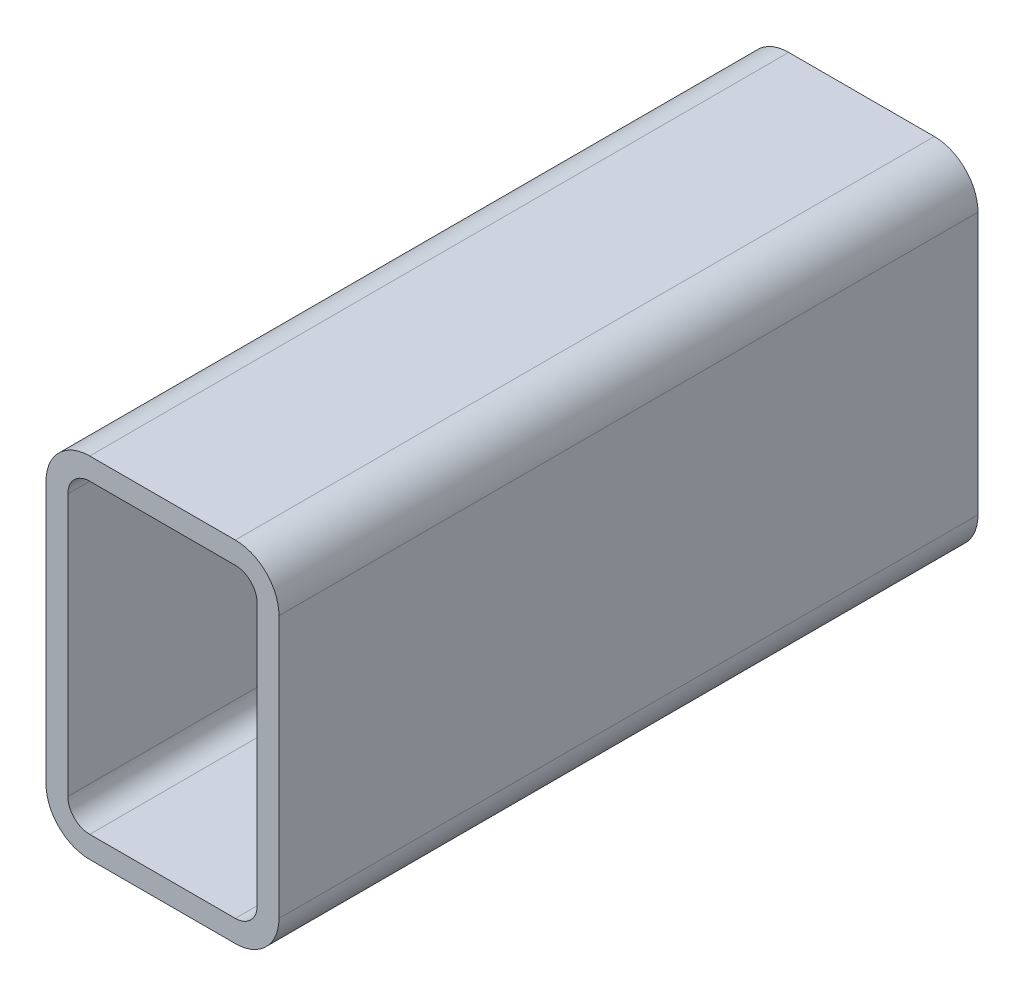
SolidWorks part; units mm, degrees
ref_plane "Front Plane" through (0, 0, 0) normal (0, 0, 1) x (1, 0, 0)
ref_plane "Top Plane" through (0, 0, 0) normal (0, 1, 0) x (1, 0, 0)
ref_plane "Right Plane" through (0, 0, 0) normal (1, 0, 0) x (0, 0, -1)
sketch "Sketch1" plane through (0, 0, 0) normal (0, 0, 1) x (1, 0, 0)
sketch_block_instance "HSS6x4x0.375-1"
sketch_block "HSS6x4x0.375"
extrude "Boss-Extrude1" add sketch "Sketch1" along normal blind 304.8
